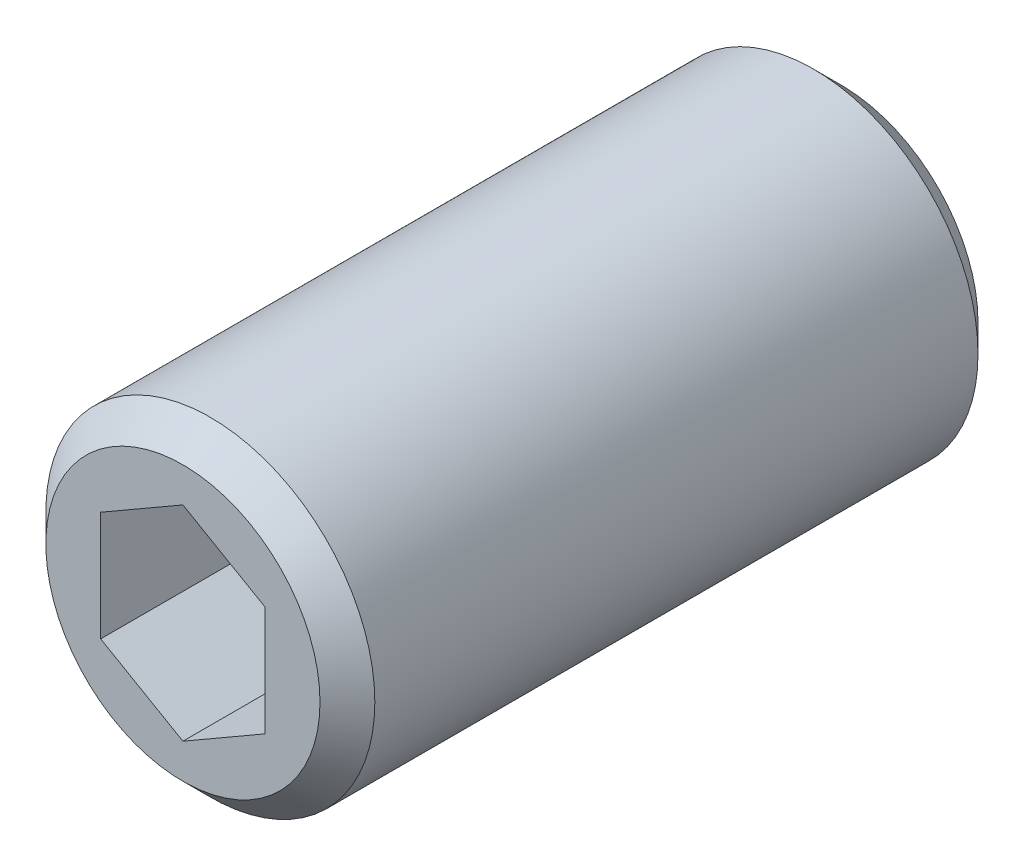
SolidWorks part; units mm, degrees
ref_plane "Plane1" through (0, 0, 0) normal (0, 0, 1) x (1, 0, 0)
ref_plane "Plane2" through (0, 0, 0) normal (0, 1, 0) x (1, 0, 0)
ref_plane "Plane3" through (0, 0, 0) normal (1, 0, 0) x (0, 0, -1)
sketch "Esquisse1" plane through (0, 0, 0) normal (0, 0, 1) x (1, 0, 0)
  circle A0 centre (0, 0) radius 3
  dimension "D1" = 6
extrude "Base-Extrusion" add sketch "Esquisse1" along normal blind 12
chamfer "Chanfrein1" distance 0.5 angle 45
sketch "Esquisse2" plane through (0, 0, 12) normal (0, 0, 1) x (1, 0, 0)
  line L0 (-1.5, 1) -> (-1.5, -1)
  line L1 (-1.5, -1) -> (0, -1.866)
  line L2 (0, -1.866) -> (1.5, -1)
  line L3 (1.5, -1) -> (1.5, 1)
  line L4 (1.5, 1) -> (0, 1.866)
  line L5 (0, 1.866) -> (-1.5, 1)
  dimension "D1" = 1.5
  dimension "D2" = 1.5
  dimension "D3" = 120
  dimension "D4" = 120
  dimension "D5" = 120
  dimension "D6" = 120
extrude "Enlèv. mat.-Extru.1" cut sketch "Esquisse2" against normal blind 4
